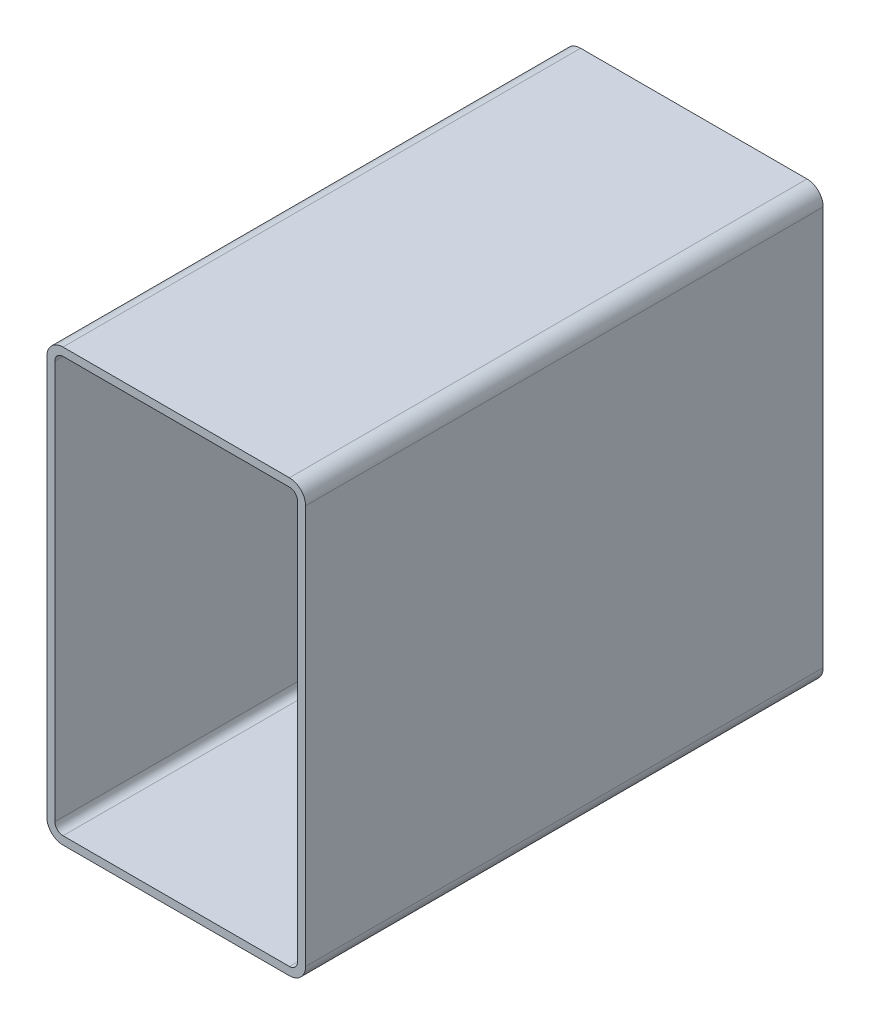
SolidWorks part; units mm, degrees
ref_plane "Front Plane" through (0, 0, 0) normal (0, 0, 1) x (1, 0, 0)
ref_plane "Top Plane" through (0, 0, 0) normal (0, 1, 0) x (1, 0, 0)
ref_plane "Right Plane" through (0, 0, 0) normal (1, 0, 0) x (0, 0, -1)
sketch "Sketch1" plane through (0, 0, 0) normal (0, 0, 1) x (1, 0, 0)
sketch_block_instance "HSS10x6x0.1875-1"
sketch_block "HSS10x6x0.1875"
extrude "Boss-Extrude1" add sketch "Sketch1" along normal blind 304.8
